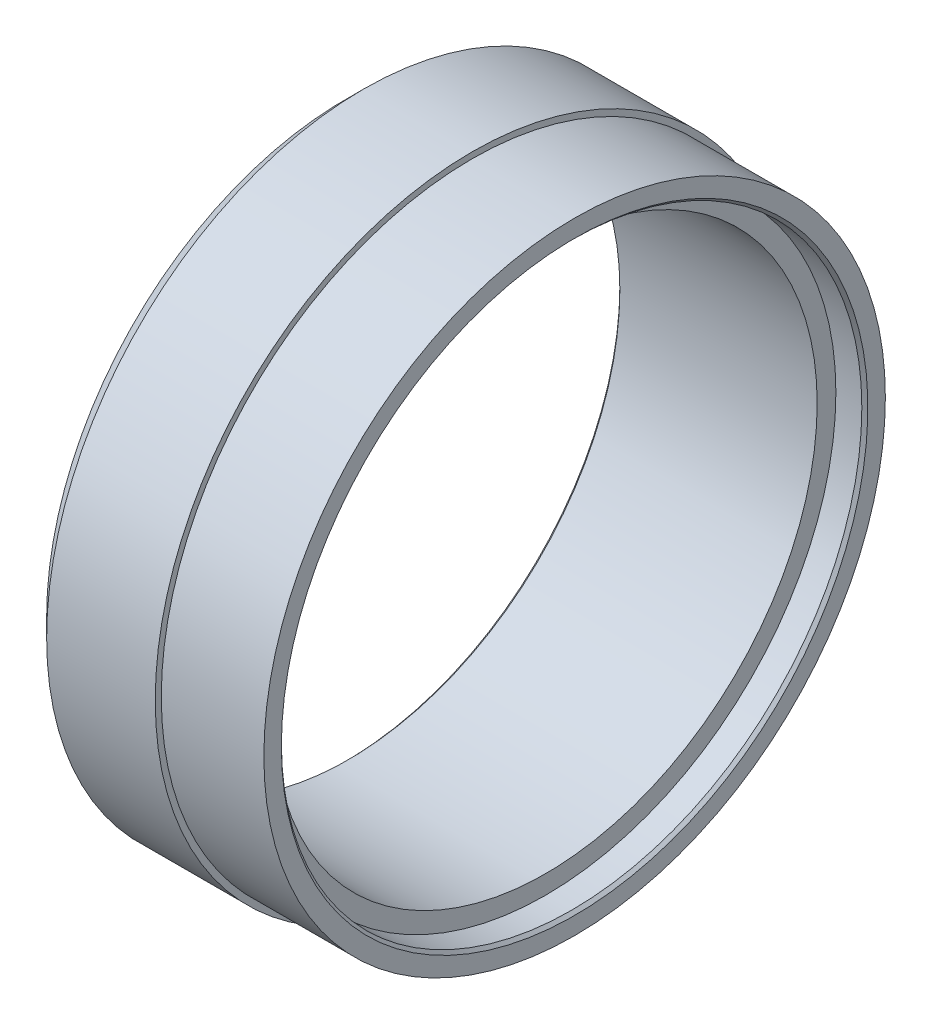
SolidWorks part; units mm, degrees
ref_plane "Face" through (0, 0, 0) normal (0, 0, 1) x (1, 0, 0)
ref_plane "Dessus" through (0, 0, 0) normal (0, 1, 0) x (1, 0, 0)
ref_plane "Droite" through (0, 0, 0) normal (1, 0, 0) x (0, 0, -1)
sketch "Esquisse1" plane through (0, 0, 0) normal (0, 0, 1) x (1, 0, 0)
  line L0 (0, 0) -> (51.9443, 0) construction
  line L1 (0, 45) -> (0, 52.5)
  line L2 (0, 52.5) -> (21, 52.5)
  line L3 (21, 52.5) -> (21, 51.5)
  line L4 (21, 51.5) -> (38, 51.5)
  line L5 (38, 51.5) -> (38, 48.1)
  line L6 (38, 48.1) -> (33.2, 48.1)
  line L7 (33.2, 48.1) -> (33.2, 45)
  line L8 (33.2, 45) -> (0, 45)
  dimension "D1" = 38
  dimension "D2" = 52.5
  dimension "D3" = 45
  dimension "D4" = 48.1
  dimension "D5" = 51.5
  dimension "D6" = 17
  dimension "D7" = 4.8
revolve "Révolution1" add sketch "Esquisse1" angle 360 about L0
chamfer "Chanfrein1" distance 3 angle 45 1 edges at (0, 0, 52.5)
chamfer "Chanfrein2" distance 0.5 angle 45 2 edges at (38, 0, 48.1) (0, 0, 45)
